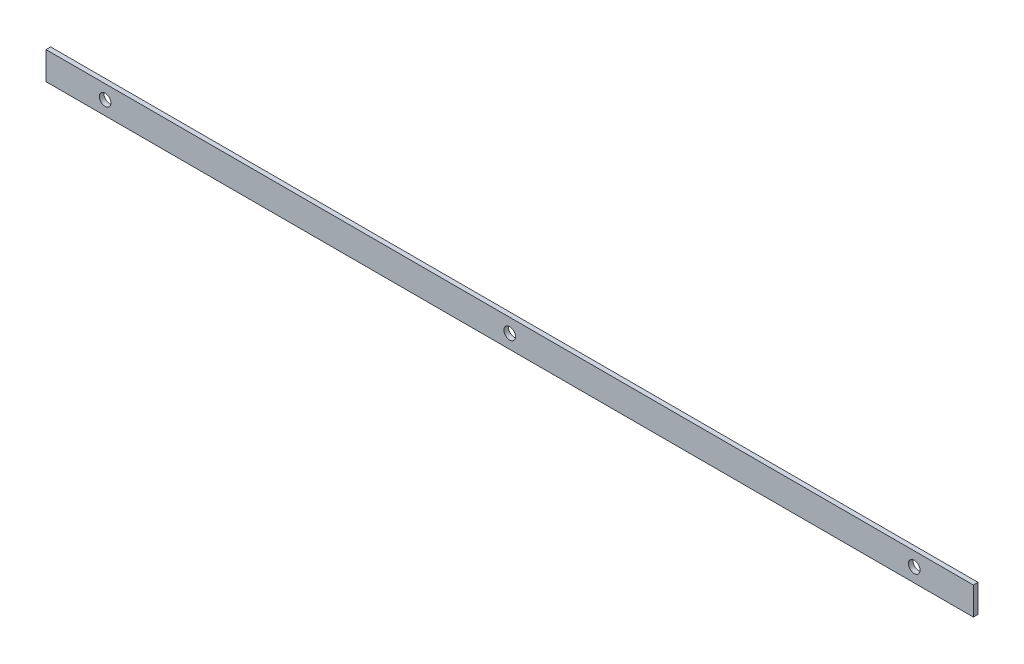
SolidWorks part; units mm, degrees
ref_plane "Plan de face" through (0, 0, 0) normal (0, 0, 1) x (1, 0, 0)
ref_plane "Plan de dessus" through (0, 0, 0) normal (0, 1, 0) x (1, 0, 0)
ref_plane "Plan de droite" through (0, 0, 0) normal (1, 0, 0) x (0, 0, -1)
sketch "Esquisse1" plane through (0, 0, 0) normal (0, 0, 1) x (1, 0, 0)
  line L1 (0, 0) -> (-800, 0)
  line L2 (0, 0) -> (0, 24)
  line L3 (0, 24) -> (-800, 24)
  line L4 (-800, 0) -> (-800, 24)
  dimension "D1" = 800
  dimension "D2" = 24
extrude "Extrusion1" add sketch "Esquisse1" along normal blind 4
sketch "Esquisse2" plane through (0, 0, 4) normal (0, 0, 1) x (1, 0, 0)
  line L0 (0, 24) -> (-800, 24) construction
  line L1 (-800, 24) -> (-800, 0) construction
  line L2 (0, 0) -> (0, 24) construction
  circle A0 centre (-749, 12) radius 5
  circle A1 centre (-400, 12) radius 5
  circle A2 centre (-51, 12) radius 5
  point P10 (0, 12)
  dimension "D2" = 10
  dimension "D3" = 10
  dimension "D4" = 10
  dimension "D6" = 349
  dimension "D1" = 12
  dimension "D5" = 51
extrude "Enlèv. mat.-Extru.1" cut sketch "Esquisse2" against normal blind 4
